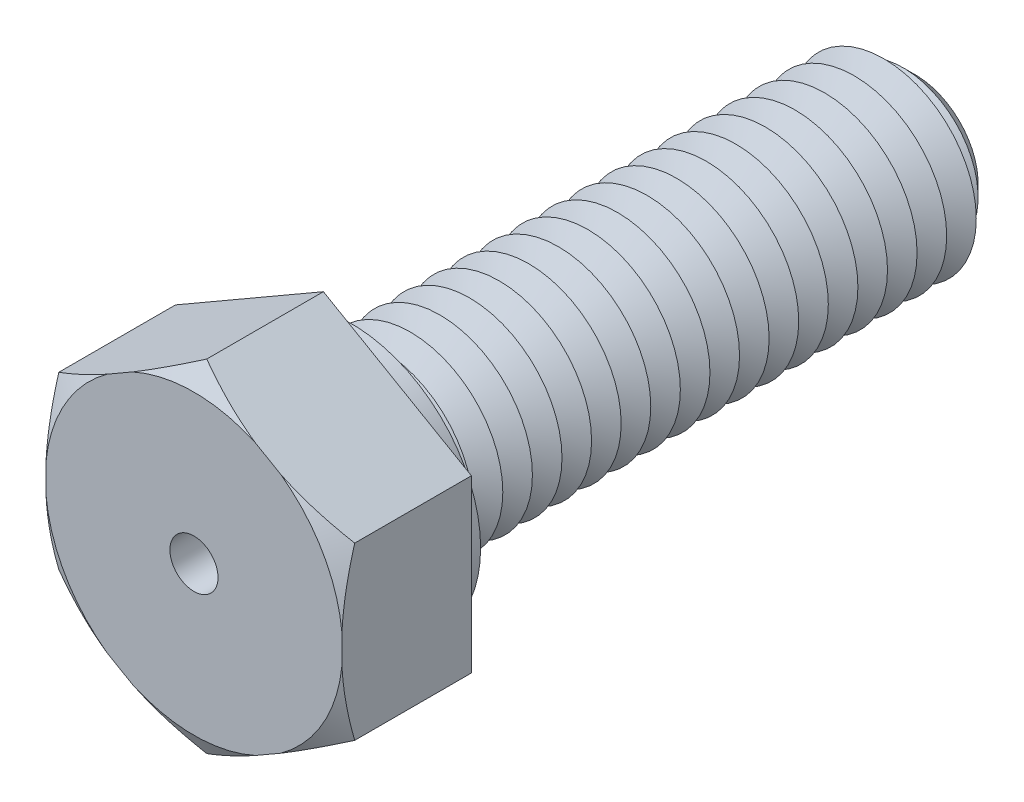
SolidWorks part; units mm, degrees
ref_plane "Front Plane" through (0, 0, 0) normal (0, 0, 1) x (1, 0, 0)
ref_plane "Top Plane" through (0, 0, 0) normal (0, 1, 0) x (1, 0, 0)
ref_plane "Right Plane" through (0, 0, 0) normal (1, 0, 0) x (0, 0, -1)
sketch "Sketch2" plane through (0, 0, 0) normal (0, 0, 1) x (1, 0, 0)
  line L1 (0, 4.6188) -> (-4, 2.3094)
  line L2 (-4, 2.3094) -> (-4, -2.3094)
  line L3 (-4, -2.3094) -> (0, -4.6188)
  line L4 (0, -4.6188) -> (4, -2.3094)
  line L5 (4, -2.3094) -> (4, 2.3094)
  line L6 (4, 2.3094) -> (0, 4.6188)
  circle A0 centre (0, 0) radius 4 construction
  dimension "D1" = 8
extrude "Boss-Extrude1" add sketch "Sketch2" along normal blind 3.5
sketch "Sketch3" plane through (0, 0, 0) normal (0, 0, -1) x (-1, 0, 0)
  circle A0 centre (0, 0) radius 2.5
  dimension "D1" = 5
extrude "Boss-Extrude2" add sketch "Sketch3" along normal blind 16
sketch "Sketch4" plane through (0, 0, 0) normal (0, 0, -1) x (-1, 0, 0)
  circle A0 centre (0, 0) radius 3.5
  dimension "D1" = 7
extrude "Boss-Extrude3" add sketch "Sketch4" along normal blind 0.75
sketch "Sketch5" plane through (0, 0, 0) normal (1, 0, 0) x (0, 0, -1)
  line L0 (-3.2117, 0) -> (6.3192, 0) construction
chamfer "Chamfer1" distance 0.8 angle 45 1 edges at (-2.5, 0, -16)
sketch "Sketch6" plane through (0, 0, 0) normal (1, 0, 0) x (0, 0, -1)
  line L0 (0.75, 2.5) -> (1.15, 1.8072)
  line L1 (1.15, 1.8072) -> (1.55, 2.5)
  line L2 (15.2, 2.5) -> (0.75, 2.5) construction
  line L3 (1.55, 2.5) -> (0.75, 2.5)
  dimension "D1" = 0.8
revolve "Cut-Revolve1" cut sketch "Sketch6" angle 360 about L0
pattern_linear "LPattern1" count 19 spacing 0.8 along (0, 0, -1) of "Cut-Revolve1"
sketch "Sketch7" plane through (0, 0, 0) normal (1, 0, 0) x (0, 0, -1)
  line L0 (-3.5, 4.6188) -> (-3.5, 4.0188)
  line L1 (-3.5, 2.3094) -> (-3.5, 4.6188) construction
  line L2 (-3.5, 4.0188) -> (-3.1536, 4.6188)
  line L3 (-3.5, 4.6188) -> (0, 4.6188) construction
  line L4 (-3.1536, 4.6188) -> (-3.5, 4.6188)
  dimension "D1" = 0.6
  dimension "D2" = 30
revolve "Cut-Revolve2" cut sketch "Sketch7" angle 360 about L0
sketch "Sketch8" plane through (0, 0, 3.5) normal (0, 0, 1) x (1, 0, 0)
  circle A0 centre (0, 0) radius 0.65
  dimension "D1" = 1.3
extrude "Cut-Extrude1" cut sketch "Sketch8" against normal up to surface (19.5 mm away)
